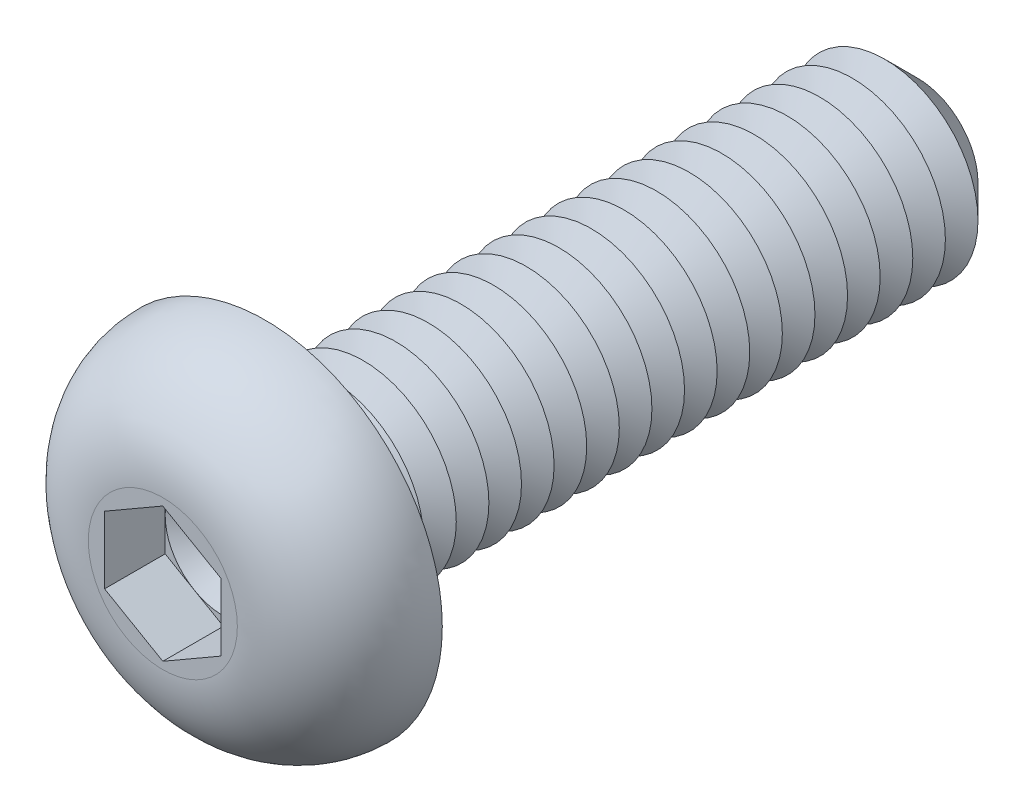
SolidWorks part; units mm, degrees
ref_plane "Front Plane" through (0, 0, 0) normal (0, 0, 1) x (1, 0, 0)
ref_plane "Top Plane" through (0, 0, 0) normal (0, 1, 0) x (1, 0, 0)
ref_plane "Right Plane" through (0, 0, 0) normal (1, 0, 0) x (0, 0, -1)
sketch "Sketch1" plane through (0, 0, 0) normal (1, 0, 0) x (0, 0, -1)
  line L0 (-47.9342, 0) -> (60.3146, 0) construction
sketch "Sketch2" plane through (0, 0, 0) normal (1, 0, 0) x (0, 0, -1)
  line L0 (0, 0) -> (-2.2, 0)
  line L1 (-47.9342, 0) -> (60.3146, 0) construction
  line L2 (-2.2, 0) -> (-2.2, 1.6)
  line L3 (0, 3.8) -> (0, 0)
  arc A0 (-2.2, 1.6) -> (0, 3.8) centre (0, 1.6) cw
  dimension "D1" = 2.2
  dimension "D2" = 2.2
  dimension "D3" = 3.8
revolve "Revolve1" add sketch "Sketch2" angle 360 about L0
sketch "Sketch3" plane through (0, 0, 2.2) normal (0, 0, 1) x (1, 0, 0)
  line L1 (0, 1.4434) -> (-1.25, 0.7217)
  line L2 (-1.25, 0.7217) -> (-1.25, -0.7217)
  line L3 (-1.25, -0.7217) -> (0, -1.4434)
  line L4 (0, -1.4434) -> (1.25, -0.7217)
  line L5 (1.25, -0.7217) -> (1.25, 0.7217)
  line L6 (1.25, 0.7217) -> (0, 1.4434)
  circle A0 centre (0, 0) radius 1.25 construction
  dimension "D1" = 2.5
extrude "Cut-Extrude1" cut sketch "Sketch3" against normal blind 1.3
sketch "Sketch4" plane through (0, 0, 0) normal (0, 0, -1) x (-1, 0, 0)
  circle A0 centre (0, 0) radius 2
  dimension "D1" = 4
extrude "Boss-Extrude1" add sketch "Sketch4" along normal blind 14
chamfer "Chamfer1" distance 0.7 angle 45 1 edges at (-2, 0, -14)
sketch "Sketch5" plane through (0, 0, 0) normal (1, 0, 0) x (0, 0, -1)
  line L0 (0.7, 2) -> (1.4, 2)
  line L1 (13.3, 2) -> (0, 2) construction
  line L2 (1.4, 2) -> (1.05, 1.3938)
  line L3 (1.05, 1.3938) -> (0.7, 2)
  line L4 (0, -3.8) -> (0, 3.8) construction
  line L5 (13.3, 2) -> (0, 2) construction
  dimension "D1" = 0.7
  dimension "D2" = 0.7
revolve "Cut-Revolve1" cut sketch "Sketch5" angle 360 about L0
pattern_linear "LPattern1" count 18 spacing 0.7 along (0, 0, -1) of "Cut-Revolve1"
fillet "Fillet2" radius 0.3 1 edges at (2, 0, 0)
sketch "Sketch6" plane through (0, 0, 0.9) normal (0, 0, 1) x (1, 0, 0)
  line L0 (0, -1.4434) -> (1.25, -0.7217) construction
  circle A0 centre (0, 0) radius 1.25
extrude "Cut-Extrude2" cut sketch "Sketch6" against normal through all draft 60
